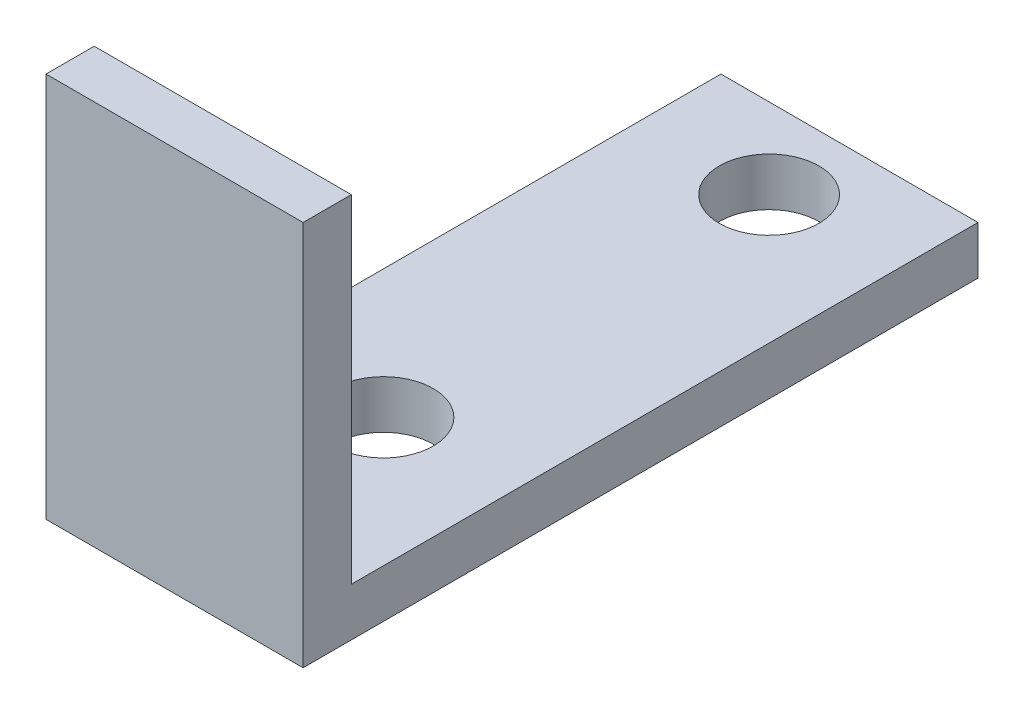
SolidWorks part; units mm, degrees
ref_plane "Front Plane" through (0, 0, 0) normal (0, 0, 1) x (1, 0, 0)
ref_plane "Top Plane" through (0, 0, 0) normal (0, 1, 0) x (1, 0, 0)
ref_plane "Right Plane" through (0, 0, 0) normal (1, 0, 0) x (0, 0, -1)
sketch "Sketch1" plane through (0, 0, 0) normal (1, 0, 0) x (0, 0, -1)
  line L0 (0, 0) -> (0, 12)
  line L1 (0, 12) -> (1.5, 12)
  line L2 (1.5, 12) -> (1.5, 1.5)
  line L3 (1.5, 1.5) -> (21, 1.5)
  line L4 (21, 1.5) -> (21, 0)
  line L5 (21, 0) -> (0, 0)
  dimension "D1" = 1.5
  dimension "D2" = 1.5
  dimension "D3" = 21
  dimension "D4" = 12
  dimension "D5" = 19.5
extrude "Boss-Extrude1" add sketch "Sketch1" along normal blind 8
hole_wizard "Ø3.1 (3.1) Diameter Hole1" positions "Sketch7" profile "Sketch6" hole size "Ø3.1" standard "ANSI Metric"
sketch "Sketch7" plane through (0, 1.5, 0) normal (0, 1, 0) x (1, 0, 0)
  line L0 (4, 18.5) -> (4, 6.5) construction
  line L2 (0, 21) -> (0, 1.5) construction
  line L3 (8, 21) -> (0, 21) construction
  point P0 (4, 18.5)
  point P2 (4, 6.5)
  dimension "D1" = 4
  dimension "D2" = 2.5
  dimension "D3" = 12
sketch "Sketch6" plane through (4, 1.5, -18.5) normal (1, 0, 0) x (0, 0, 1)
  line L0 (0, 0) -> (0, 1.5)
  line L1 (0, 1.5) -> (1.55, 1.5)
  line L2 (1.55, 1.5) -> (1.55, 0)
  line L5 (1.55, 0) -> (0, 0)
  line L11 (0, -6.35) -> (0, 107.95) construction
  dimension "Thru Hole Dia." = 3.1
  dimension "Thru Hole Depth" = 1.5
